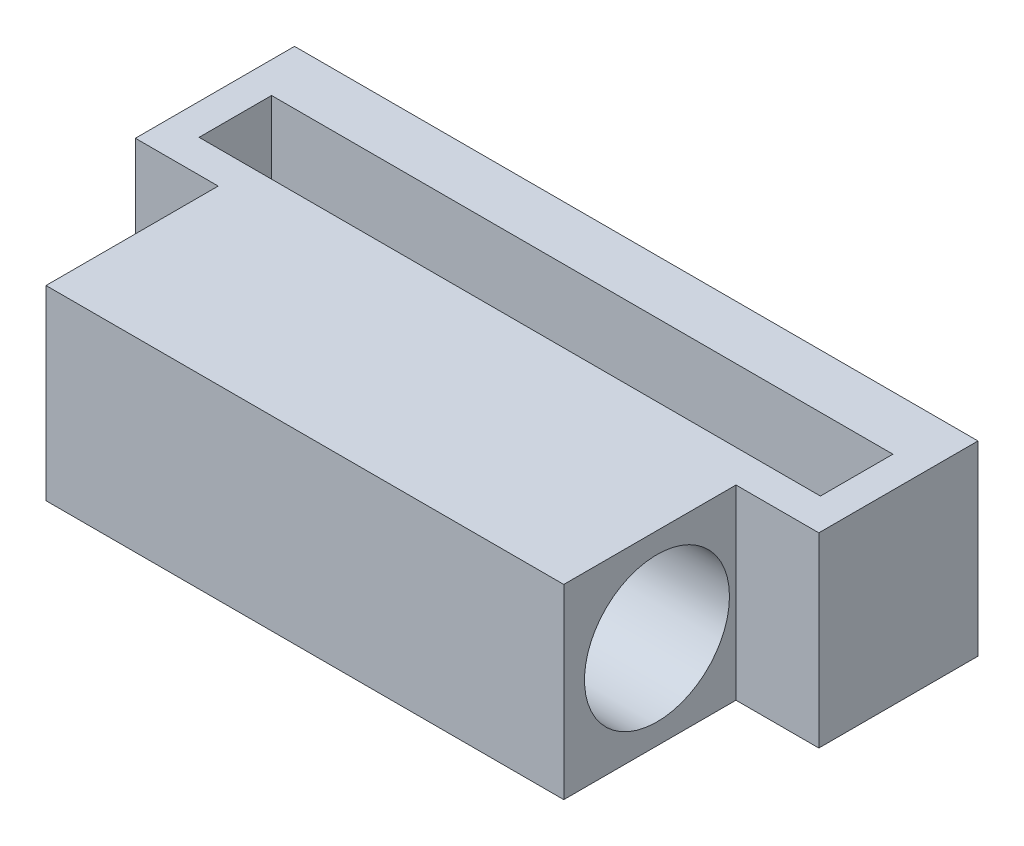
SolidWorks part; units mm, degrees
ref_plane "Plan de face" through (0, 0, 0) normal (0, 0, 1) x (1, 0, 0)
ref_plane "Plan de dessus" through (0, 0, 0) normal (0, 1, 0) x (1, 0, 0)
ref_plane "Plan de droite" through (0, 0, 0) normal (1, 0, 0) x (0, 0, -1)
sketch "Esquisse1" plane through (0, 0, 0) normal (0, 1, 0) x (1, 0, 0)
  line L1 (0, 0) -> (25, 0)
  line L2 (0, 0) -> (0, 16)
  line L3 (0, 16) -> (25, 16)
  line L4 (25, 0) -> (25, 16)
  dimension "D1" = 25
  dimension "D2" = 16
extrude "Boss.-Extru.1" add sketch "Esquisse1" along normal blind 9
sketch "Esquisse2" plane through (25, 0, 0) normal (1, 0, 0) x (0, 0, -1)
  line L0 (0, 9) -> (16, 9) construction
  line L1 (0, 9) -> (0, 0) construction
  circle A0 centre (4.5, 4.5) radius 3.5
  dimension "D3" = 7
  dimension "D1" = 4.5
  dimension "D2" = 4.5
extrude "Enlèv. mat.-Extru.1" cut sketch "Esquisse2" against normal through all
sketch "Esquisse3" plane through (0, 9, 0) normal (0, 1, 0) x (1, 0, 0)
  line L0 (25, 16) -> (0, 16) construction
  line L1 (-2.5, 13.3908) -> (27.5, 13.3908)
  line L2 (-2.5, 13.3908) -> (-2.5, 9.8908)
  line L3 (-2.5, 9.8908) -> (27.5, 9.8908)
  line L4 (27.5, 13.3908) -> (27.5, 9.8908)
  point P4 (12.5, 13.3908)
  point P7 (12.5, 16)
  dimension "D1" = 3.5
  dimension "D2" = 30
  dimension "D3" = 0
sketch "Esquisse5" plane through (25, 0, 0) normal (1, 0, 0) x (0, 0, -1)
  line L0 (0, 9) -> (16, 9) construction
  line L1 (8.315, 9) -> (16, 9)
  line L2 (8.315, 9) -> (8.315, 0)
  line L3 (8.315, 0) -> (16, 0)
  line L4 (16, 9) -> (16, 0)
  dimension "D1" = 7.685
extrude "Boss.-Extru.2" add sketch "Esquisse5" along normal blind 4 and the other way blind 29
extrude "Enlèv. mat.-Extru.3" cut sketch "Esquisse3" against normal through all
